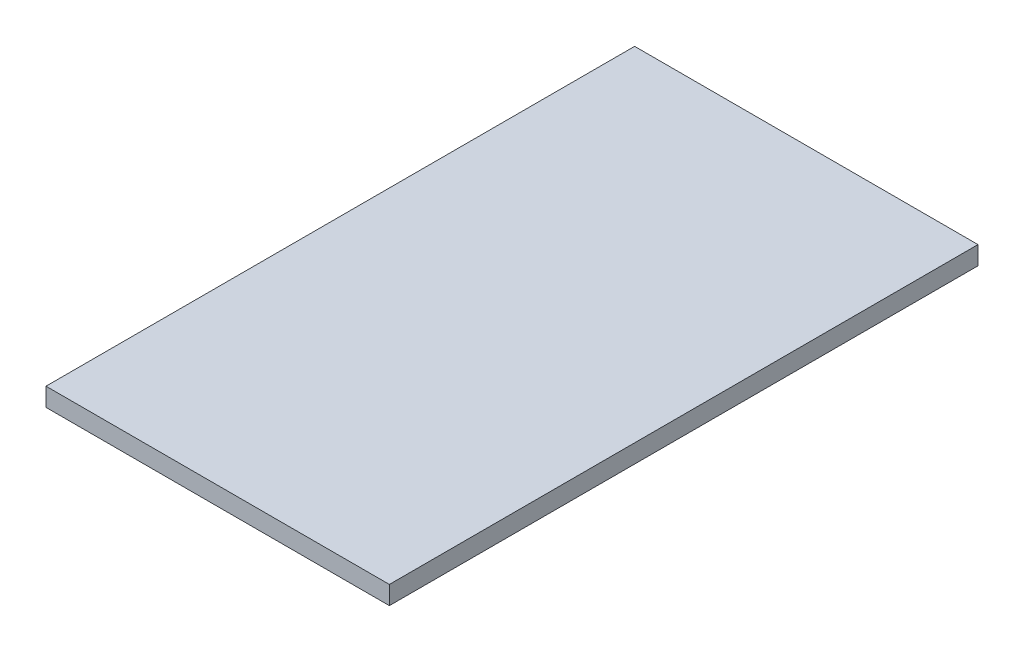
SolidWorks part; units mm, degrees
ref_plane "Front Plane" through (0, 0, 0) normal (0, 0, 1) x (1, 0, 0)
ref_plane "Top Plane" through (0, 0, 0) normal (0, 1, 0) x (1, 0, 0)
ref_plane "Right Plane" through (0, 0, 0) normal (1, 0, 0) x (0, 0, -1)
sketch "Sketch1" plane through (0, 0, 0) normal (0, 1, 0) x (1, 0, 0)
  line L1 (0, 0) -> (88.9, 0)
  line L2 (0, 0) -> (0, 152.4)
  line L3 (0, 152.4) -> (88.9, 152.4)
  line L4 (88.9, 0) -> (88.9, 152.4)
  dimension "D1" = 88.9
  dimension "D2" = 152.4
extrude "Boss-Extrude1" add sketch "Sketch1" along normal blind 4.7625
sketch "Sketch2" plane through (0, 0, 0) normal (0, 0, 1) x (1, 0, 0)
  line L0 (0, 4.7625) -> (88.9, 4.7625) construction
  line L1 (2.54, 4.445) -> (7.62, 4.445)
  line L2 (2.54, 4.445) -> (2.54, 0.3175)
  line L3 (2.54, 0.3175) -> (7.62, 0.3175)
  line L4 (7.62, 4.445) -> (7.62, 0.3175)
  line L5 (0, 0) -> (88.9, 0) construction
  line L8 (0, 4.7625) -> (0, 0) construction
  dimension "D1" = 0.3175
  dimension "D2" = 0.3175
  dimension "D3" = 2.54
  dimension "D4" = 5.08
extrude "Cut-Extrude3" [suppressed] cut sketch "Sketch2" against normal through all
pattern_linear "LPattern1" [suppressed] count 16 spacing 5.3975 count 2 spacing 5.3975
